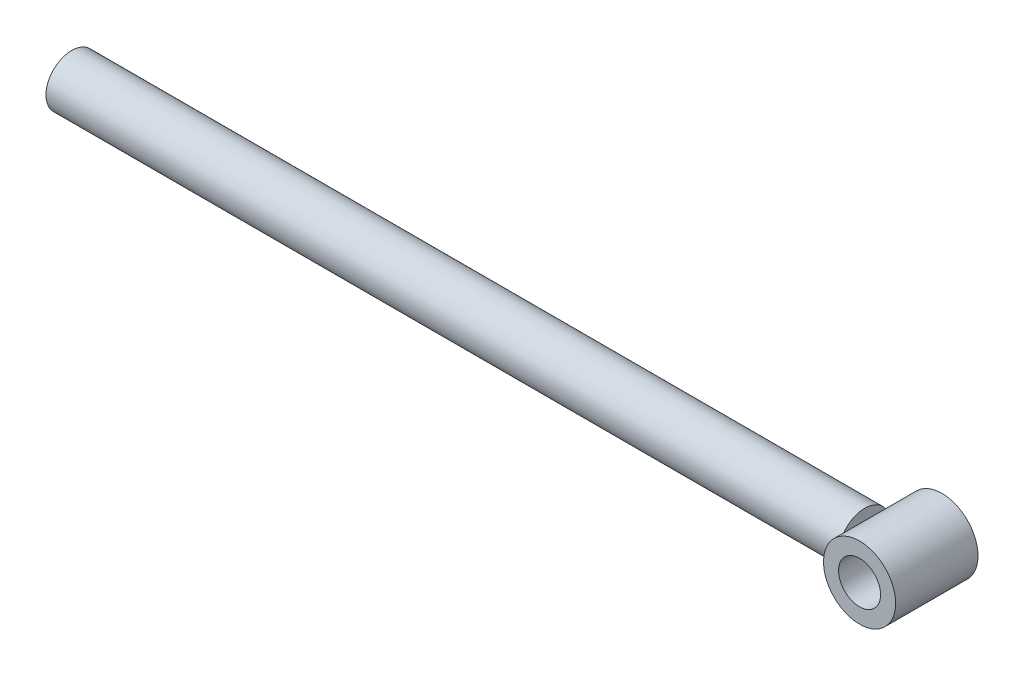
SolidWorks part; units mm, degrees
ref_plane "Plan de face" through (0, 0, 0) normal (0, 0, 1) x (1, 0, 0)
ref_plane "Plan de dessus" through (0, 0, 0) normal (0, 1, 0) x (1, 0, 0)
ref_plane "Plan de droite" through (0, 0, 0) normal (1, 0, 0) x (0, 0, -1)
sketch "Esquisse1" plane through (0, 0, 0) normal (1, 0, 0) x (0, 0, -1)
  circle A0 centre (0, 0) radius 12.5
  dimension "D1" = 25
extrude "Extrusion1" add sketch "Esquisse1" along normal blind 385
sketch "Esquisse2" plane through (0, 0, 0) normal (0, 0, 1) x (1, 0, 0)
  line L0 (385, -12.5) -> (385, 12.5) construction
  circle A0 centre (402.5, 0) radius 17.5
  circle A1 centre (402.5, 0) radius 10.2
  dimension "D1" = 20.4
  dimension "D2" = 35
extrude "Extrusion2" add sketch "Esquisse2" along normal mid plane 40
ref_plane "Plan1" through (372, 0, 0) normal (1, 0, 0) x (0, 0, -1)
